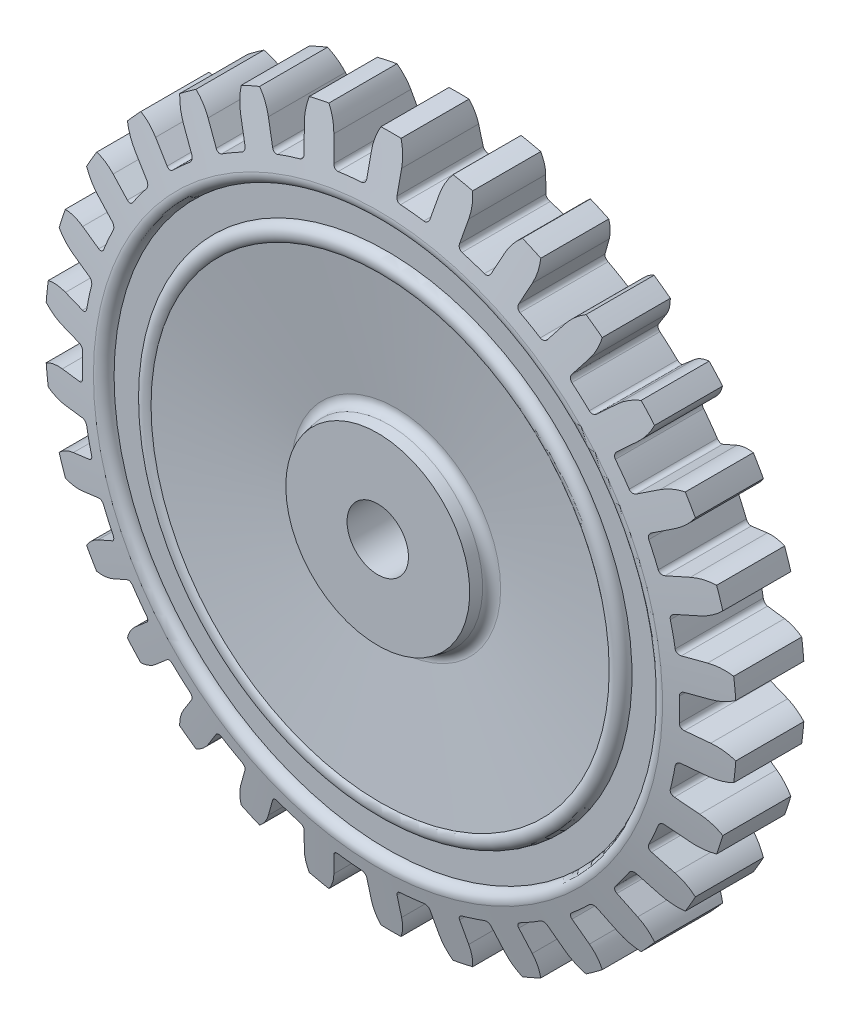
SolidWorks part; units mm, degrees
ref_plane "Спереди" through (0, 0, 0) normal (0, 0, 1) x (1, 0, 0)
ref_plane "Сверху" through (0, 0, 0) normal (0, 1, 0) x (1, 0, 0)
ref_plane "Справа" through (0, 0, 0) normal (1, 0, 0) x (0, 0, -1)
sketch "Эскиз1" plane through (0, 0, 0) normal (0, 1, 0) x (1, 0, 0)
  line L0 (-36.6, 0) -> (0, 0) construction
  line L1 (-36.6, -3.6) -> (-36.6, 3.6)
  line L2 (-3.25, 5) -> (-3.25, -5)
  line L3 (-3.25, 5) -> (-9.735, 5)
  line L4 (-36.6, 3.6) -> (-30.1163, 4.9781)
  line L5 (-28.9084, 4) -> (-25.9084, 4)
  line L6 (-9.735, 5) -> (-9.9607, 3.8603)
  line L7 (-11.0686, 3.0627) -> (-24.247, 4.75)
  line L8 (-3.25, -5) -> (-9.735, -5)
  line L9 (-9.735, -5) -> (-9.9607, -3.8603)
  line L10 (-11.0686, -3.0627) -> (-24.247, -4.75)
  line L11 (-28.9084, -4) -> (-25.9084, -4)
  line L12 (-36.6, -3.6) -> (-30.1163, -4.9781)
  line L13 (0, 5) -> (0, -5) construction
  arc A0 (-28.9084, 4) -> (-30.1163, 4.9781) centre (-29.9084, 4) ccw
  arc A1 (-24.247, 4.75) -> (-25.9084, 4) centre (-24.9084, 4) ccw
  arc A2 (-9.9607, 3.8603) -> (-11.0686, 3.0627) centre (-10.9416, 4.0546) cw
  arc A3 (-9.9607, -3.8603) -> (-11.0686, -3.0627) centre (-10.9416, -4.0546) ccw
  arc A4 (-24.247, -4.75) -> (-25.9084, -4) centre (-24.9084, -4) cw
  arc A5 (-28.9084, -4) -> (-30.1163, -4.9781) centre (-29.9084, -4) cw
  point P17 (-3.25, 0)
  dimension "D7" = 2
  dimension "D13" = 1
  dimension "D1" = 36.6
  dimension "D2" = 3.25
  dimension "D3" = 5
  dimension "D4" = 6.485
  dimension "D5" = 3.6
  dimension "D6" = 12
  dimension "D8" = 3
  dimension "D9" = 4
  dimension "D10" = 11.2
  dimension "D11" = 7.296
  dimension "D12" = 0.25
revolve "Повернуть1" add sketch "Эскиз1" angle 360 about L13
sketch "Эскиз6" plane through (0, 0, 0) normal (0, 0, 1) x (1, 0, 0)
  line L0 (0, 50.9999) -> (0, 0) construction
  line L1 (1.6, 34.3321) -> (1.6, 32.0312)
  line L2 (0, 0) -> (3.3816, 34.3339) construction
  line L3 (-1.6, 34.3321) -> (-1.6, 32.0312)
  line L4 (8.7031, 33.2492) -> (8.2247, 30.9986)
  line L5 (5.573, 33.9145) -> (5.0946, 31.6639)
  line L6 (15.4258, 30.7131) -> (14.4899, 28.6112)
  line L7 (12.5024, 32.0147) -> (11.5666, 29.9128)
  line L8 (21.4743, 26.8348) -> (20.1219, 24.9734)
  line L9 (18.8854, 28.7157) -> (17.5331, 26.8543)
  line L10 (26.5843, 21.7836) -> (24.8745, 20.244)
  line L11 (24.4431, 24.1617) -> (22.7332, 22.6221)
  line L12 (30.5324, 15.7804) -> (28.5399, 14.63)
  line L13 (28.9324, 18.5517) -> (26.9399, 17.4013)
  line L14 (33.1462, 9.0875) -> (30.9579, 8.3765)
  line L15 (32.1573, 12.1309) -> (29.9691, 11.4199)
  line L16 (34.3112, 1.9974) -> (32.023, 1.7569)
  line L17 (33.9767, 5.1799) -> (31.6885, 4.9394)
  line L18 (33.9767, -5.1799) -> (31.6885, -4.9394)
  line L19 (34.3112, -1.9974) -> (32.023, -1.7569)
  line L20 (32.1573, -12.1309) -> (29.9691, -11.4199)
  line L21 (33.1462, -9.0875) -> (30.9579, -8.3765)
  line L22 (28.9324, -18.5517) -> (26.9399, -17.4013)
  line L23 (30.5324, -15.7804) -> (28.5399, -14.63)
  line L24 (24.4431, -24.1617) -> (22.7332, -22.6221)
  line L25 (26.5843, -21.7836) -> (24.8745, -20.244)
  line L26 (18.8854, -28.7157) -> (17.5331, -26.8543)
  line L27 (21.4743, -26.8348) -> (20.1219, -24.9734)
  line L28 (12.5024, -32.0147) -> (11.5666, -29.9128)
  line L29 (15.4258, -30.7131) -> (14.4899, -28.6112)
  line L30 (5.573, -33.9145) -> (5.0946, -31.6639)
  line L31 (8.7031, -33.2492) -> (8.2247, -30.9986)
  line L32 (-1.6, -34.3321) -> (-1.6, -32.0312)
  line L33 (1.6, -34.3321) -> (1.6, -32.0312)
  line L34 (-8.7031, -33.2492) -> (-8.2247, -30.9986)
  line L35 (-5.573, -33.9145) -> (-5.0946, -31.6639)
  line L36 (-15.4258, -30.7131) -> (-14.4899, -28.6112)
  line L37 (-12.5024, -32.0147) -> (-11.5666, -29.9128)
  line L38 (-21.4743, -26.8348) -> (-20.1219, -24.9734)
  line L39 (-18.8854, -28.7157) -> (-17.5331, -26.8543)
  line L40 (-26.5843, -21.7836) -> (-24.8745, -20.244)
  line L41 (-24.4431, -24.1617) -> (-22.7332, -22.6221)
  line L42 (-30.5324, -15.7804) -> (-28.5399, -14.63)
  line L43 (-28.9324, -18.5517) -> (-26.9399, -17.4013)
  line L44 (-33.1462, -9.0875) -> (-30.9579, -8.3765)
  line L45 (-32.1573, -12.1309) -> (-29.9691, -11.4199)
  line L46 (-34.3112, -1.9974) -> (-32.023, -1.7569)
  line L47 (-33.9767, -5.1799) -> (-31.6885, -4.9394)
  line L48 (-33.9767, 5.1799) -> (-31.6885, 4.9394)
  line L49 (-34.3112, 1.9974) -> (-32.023, 1.7569)
  line L50 (-32.1573, 12.1309) -> (-29.9691, 11.4199)
  line L51 (-33.1462, 9.0875) -> (-30.9579, 8.3765)
  line L52 (-28.9324, 18.5517) -> (-26.9399, 17.4013)
  line L53 (-30.5324, 15.7804) -> (-28.5399, 14.63)
  line L54 (-24.4431, 24.1617) -> (-22.7332, 22.6221)
  line L55 (-26.5843, 21.7836) -> (-24.8745, 20.244)
  line L56 (-18.8854, 28.7157) -> (-17.5331, 26.8543)
  line L57 (-21.4743, 26.8348) -> (-20.1219, 24.9734)
  line L58 (-12.5024, 32.0147) -> (-11.5666, 29.9128)
  line L59 (-15.4258, 30.7131) -> (-14.4899, 28.6112)
  line L60 (-5.573, 33.9145) -> (-5.0946, 31.6639)
  line L61 (-8.7031, 33.2492) -> (-8.2247, 30.9986)
  arc A0 (-2.0673, 31.5323) -> (-4.5338, 31.2731) centre (0, 0) ccw
  circle A1 centre (0, 0) radius 34.5 construction
  circle A2 centre (0, 0) radius 36.6 construction
  arc A3 (1.0639, 36.5845) -> (-1.0639, 36.5845) centre (0, 0) ccw
  arc A4 (-1.0639, 36.5845) -> (-1.6, 34.3321) centre (3.4, 34.3321) ccw
  arc A5 (1.6, 32.0312) -> (2.0673, 31.5323) centre (2.1, 32.0312) ccw
  arc A6 (1.0639, 36.5845) -> (1.6, 34.3321) centre (-3.4, 34.3321) cw
  arc A7 (4.5338, 31.2731) -> (2.0673, 31.5323) centre (0, 0) ccw
  arc A8 (8.647, 35.5639) -> (6.5657, 36.0063) centre (0, 0) ccw
  arc A9 (6.5657, 36.0063) -> (5.573, 33.9145) centre (10.4637, 32.8749) ccw
  arc A10 (8.2247, 30.9986) -> (8.578, 30.4134) centre (8.7138, 30.8947) ccw
  arc A11 (8.647, 35.5639) -> (8.7031, 33.2492) centre (3.8123, 34.2887) cw
  arc A12 (5.0946, 31.6639) -> (4.5338, 31.2731) centre (4.6056, 31.7679) cw
  arc A13 (10.9368, 29.647) -> (8.578, 30.4134) centre (0, 0) ccw
  arc A14 (15.8522, 32.9889) -> (13.9084, 33.8544) centre (0, 0) ccw
  arc A15 (13.9084, 33.8544) -> (12.5024, 32.0147) centre (17.0702, 29.981) ccw
  arc A16 (14.4899, 28.6112) -> (14.7139, 27.9654) centre (14.9467, 28.4078) ccw
  arc A17 (15.8522, 32.9889) -> (15.4258, 30.7131) centre (10.8581, 32.7468) cw
  arc A18 (11.5666, 29.9128) -> (10.9368, 29.647) centre (11.1098, 30.1161) cw
  arc A19 (16.8618, 26.7253) -> (14.7139, 27.9654) centre (0, 0) ccw
  arc A20 (22.3646, 28.9722) -> (20.6431, 30.2229) centre (0, 0) ccw
  arc A21 (20.6431, 30.2229) -> (18.8854, 28.7157) centre (22.9305, 25.7767) ccw
  arc A22 (20.1219, 24.9734) -> (20.2067, 24.295) centre (20.5264, 24.6795) ccw
  arc A23 (22.3646, 28.9722) -> (21.4743, 26.8348) centre (17.4292, 29.7737) cw
  arc A24 (17.5331, 26.8543) -> (16.8618, 26.7253) centre (17.1286, 27.1482) cw
  arc A25 (22.0498, 22.6355) -> (20.2067, 24.295) centre (0, 0) ccw
  arc A26 (27.8995, 23.6892) -> (26.4757, 25.2705) centre (0, 0) ccw
  arc A27 (26.4757, 25.2705) -> (24.4431, 24.1617) centre (27.7887, 20.4459) ccw
  arc A28 (24.8745, 20.244) -> (24.8164, 19.5629) centre (25.209, 19.8725) ccw
  arc A29 (27.8995, 23.6892) -> (26.5843, 21.7836) centre (23.2386, 25.4993) cw
  arc A30 (22.7332, 22.6221) -> (22.0498, 22.6355) centre (22.3987, 22.9937) cw
  arc A31 (26.2741, 17.5565) -> (24.8164, 19.5629) centre (0, 0) ccw
  arc A32 (32.2151, 17.3709) -> (31.1512, 19.2136) centre (0, 0) ccw
  arc A33 (31.1512, 19.2136) -> (28.9324, 18.5517) centre (31.4324, 14.2215) ccw
  arc A34 (28.5399, 14.63) -> (28.3414, 13.9758) centre (28.7899, 14.197) ccw
  arc A35 (32.2151, 17.3709) -> (30.5324, 15.7804) centre (28.0324, 20.1105) cw
  arc A36 (26.9399, 17.4013) -> (26.2741, 17.5565) centre (26.6899, 17.8343) cw
  arc A37 (29.3502, 11.7101) -> (28.3414, 13.9758) centre (0, 0) ccw
  arc A38 (35.1227, 10.2934) -> (34.4652, 12.3171) centre (0, 0) ccw
  arc A39 (34.4652, 12.3171) -> (32.1573, 12.1309) centre (33.7024, 7.3756) ccw
  arc A40 (30.9579, 8.3765) -> (30.6278, 7.7779) centre (31.1125, 7.901) ccw
  arc A41 (35.1227, 10.2934) -> (33.1462, 9.0875) centre (31.6011, 13.8428) cw
  arc A42 (29.9691, 11.4199) -> (29.3502, 11.7101) centre (29.8146, 11.8954) cw
  arc A43 (31.1435, 5.352) -> (30.6278, 7.7779) centre (0, 0) ccw
  arc A44 (36.4953, 2.7661) -> (36.2729, 4.8822) centre (0, 0) ccw
  arc A45 (36.2729, 4.8822) -> (33.9767, 5.1799) centre (34.4994, 0.2073) ccw
  arc A46 (32.023, 1.7569) -> (31.5757, 1.2401) centre (32.0753, 1.2597) ccw
  arc A47 (36.4953, 2.7661) -> (34.3112, 1.9974) centre (33.7886, 6.9701) cw
  arc A48 (31.6885, 4.9394) -> (31.1435, 5.352) centre (31.6363, 5.4367) cw
  arc A49 (31.5757, -1.2401) -> (31.5757, 1.2401) centre (0, 0) ccw
  arc A50 (36.2729, -4.8822) -> (36.4953, -2.7661) centre (0, 0) ccw
  arc A51 (36.4953, -2.7661) -> (34.3112, -1.9974) centre (33.7886, -6.9701) ccw
  arc A52 (31.6885, -4.9394) -> (31.1435, -5.352) centre (31.6363, -5.4367) ccw
  arc A53 (36.2729, -4.8822) -> (33.9767, -5.1799) centre (34.4994, -0.2073) cw
  arc A54 (32.023, -1.7569) -> (31.5757, -1.2401) centre (32.0753, -1.2597) cw
  arc A55 (30.6278, -7.7779) -> (31.1435, -5.352) centre (0, 0) ccw
  arc A56 (34.4652, -12.3171) -> (35.1227, -10.2934) centre (0, 0) ccw
  arc A57 (35.1227, -10.2934) -> (33.1462, -9.0875) centre (31.6011, -13.8428) ccw
  arc A58 (29.9691, -11.4199) -> (29.3502, -11.7101) centre (29.8146, -11.8954) ccw
  arc A59 (34.4652, -12.3171) -> (32.1573, -12.1309) centre (33.7024, -7.3756) cw
  arc A60 (30.9579, -8.3765) -> (30.6278, -7.7779) centre (31.1125, -7.901) cw
  arc A61 (28.3414, -13.9758) -> (29.3502, -11.7101) centre (0, 0) ccw
  arc A62 (31.1512, -19.2136) -> (32.2151, -17.3709) centre (0, 0) ccw
  arc A63 (32.2151, -17.3709) -> (30.5324, -15.7804) centre (28.0324, -20.1105) ccw
  arc A64 (26.9399, -17.4013) -> (26.2741, -17.5565) centre (26.6899, -17.8343) ccw
  arc A65 (31.1512, -19.2136) -> (28.9324, -18.5517) centre (31.4324, -14.2215) cw
  arc A66 (28.5399, -14.63) -> (28.3414, -13.9758) centre (28.7899, -14.197) cw
  arc A67 (24.8164, -19.5629) -> (26.2741, -17.5565) centre (0, 0) ccw
  arc A68 (26.4757, -25.2705) -> (27.8995, -23.6892) centre (0, 0) ccw
  arc A69 (27.8995, -23.6892) -> (26.5843, -21.7836) centre (23.2386, -25.4993) ccw
  arc A70 (22.7332, -22.6221) -> (22.0498, -22.6355) centre (22.3987, -22.9937) ccw
  arc A71 (26.4757, -25.2705) -> (24.4431, -24.1617) centre (27.7887, -20.4459) cw
  arc A72 (24.8745, -20.244) -> (24.8164, -19.5629) centre (25.209, -19.8725) cw
  arc A73 (20.2067, -24.295) -> (22.0498, -22.6355) centre (0, 0) ccw
  arc A74 (20.6431, -30.2229) -> (22.3646, -28.9722) centre (0, 0) ccw
  arc A75 (22.3646, -28.9722) -> (21.4743, -26.8348) centre (17.4292, -29.7737) ccw
  arc A76 (17.5331, -26.8543) -> (16.8618, -26.7253) centre (17.1286, -27.1482) ccw
  arc A77 (20.6431, -30.2229) -> (18.8854, -28.7157) centre (22.9305, -25.7767) cw
  arc A78 (20.1219, -24.9734) -> (20.2067, -24.295) centre (20.5264, -24.6795) cw
  arc A79 (14.7139, -27.9654) -> (16.8618, -26.7253) centre (0, 0) ccw
  arc A80 (13.9084, -33.8544) -> (15.8522, -32.9889) centre (0, 0) ccw
  arc A81 (15.8522, -32.9889) -> (15.4258, -30.7131) centre (10.8581, -32.7468) ccw
  arc A82 (11.5666, -29.9128) -> (10.9368, -29.647) centre (11.1098, -30.1161) ccw
  arc A83 (13.9084, -33.8544) -> (12.5024, -32.0147) centre (17.0702, -29.981) cw
  arc A84 (14.4899, -28.6112) -> (14.7139, -27.9654) centre (14.9467, -28.4078) cw
  arc A85 (8.578, -30.4134) -> (10.9368, -29.647) centre (0, 0) ccw
  arc A86 (6.5657, -36.0063) -> (8.647, -35.5639) centre (0, 0) ccw
  arc A87 (8.647, -35.5639) -> (8.7031, -33.2492) centre (3.8123, -34.2887) ccw
  arc A88 (5.0946, -31.6639) -> (4.5338, -31.2731) centre (4.6056, -31.7679) ccw
  arc A89 (6.5657, -36.0063) -> (5.573, -33.9145) centre (10.4637, -32.8749) cw
  arc A90 (8.2247, -30.9986) -> (8.578, -30.4134) centre (8.7138, -30.8947) cw
  arc A91 (2.0673, -31.5323) -> (4.5338, -31.2731) centre (0, 0) ccw
  arc A92 (-1.0639, -36.5845) -> (1.0639, -36.5845) centre (0, 0) ccw
  arc A93 (1.0639, -36.5845) -> (1.6, -34.3321) centre (-3.4, -34.3321) ccw
  arc A94 (-1.6, -32.0312) -> (-2.0673, -31.5323) centre (-2.1, -32.0312) ccw
  arc A95 (-1.0639, -36.5845) -> (-1.6, -34.3321) centre (3.4, -34.3321) cw
  arc A96 (1.6, -32.0312) -> (2.0673, -31.5323) centre (2.1, -32.0312) cw
  arc A97 (-4.5338, -31.2731) -> (-2.0673, -31.5323) centre (0, 0) ccw
  arc A98 (-8.647, -35.5639) -> (-6.5657, -36.0063) centre (0, 0) ccw
  arc A99 (-6.5657, -36.0063) -> (-5.573, -33.9145) centre (-10.4637, -32.8749) ccw
  arc A100 (-8.2247, -30.9986) -> (-8.578, -30.4134) centre (-8.7138, -30.8947) ccw
  arc A101 (-8.647, -35.5639) -> (-8.7031, -33.2492) centre (-3.8123, -34.2887) cw
  arc A102 (-5.0946, -31.6639) -> (-4.5338, -31.2731) centre (-4.6056, -31.7679) cw
  arc A103 (-10.9368, -29.647) -> (-8.578, -30.4134) centre (0, 0) ccw
  arc A104 (-15.8522, -32.9889) -> (-13.9084, -33.8544) centre (0, 0) ccw
  arc A105 (-13.9084, -33.8544) -> (-12.5024, -32.0147) centre (-17.0702, -29.981) ccw
  arc A106 (-14.4899, -28.6112) -> (-14.7139, -27.9654) centre (-14.9467, -28.4078) ccw
  arc A107 (-15.8522, -32.9889) -> (-15.4258, -30.7131) centre (-10.8581, -32.7468) cw
  arc A108 (-11.5666, -29.9128) -> (-10.9368, -29.647) centre (-11.1098, -30.1161) cw
  arc A109 (-16.8618, -26.7253) -> (-14.7139, -27.9654) centre (0, 0) ccw
  arc A110 (-22.3646, -28.9722) -> (-20.6431, -30.2229) centre (0, 0) ccw
  arc A111 (-20.6431, -30.2229) -> (-18.8854, -28.7157) centre (-22.9305, -25.7767) ccw
  arc A112 (-20.1219, -24.9734) -> (-20.2067, -24.295) centre (-20.5264, -24.6795) ccw
  arc A113 (-22.3646, -28.9722) -> (-21.4743, -26.8348) centre (-17.4292, -29.7737) cw
  arc A114 (-17.5331, -26.8543) -> (-16.8618, -26.7253) centre (-17.1286, -27.1482) cw
  arc A115 (-22.0498, -22.6355) -> (-20.2067, -24.295) centre (0, 0) ccw
  arc A116 (-27.8995, -23.6892) -> (-26.4757, -25.2705) centre (0, 0) ccw
  arc A117 (-26.4757, -25.2705) -> (-24.4431, -24.1617) centre (-27.7887, -20.4459) ccw
  arc A118 (-24.8745, -20.244) -> (-24.8164, -19.5629) centre (-25.209, -19.8725) ccw
  arc A119 (-27.8995, -23.6892) -> (-26.5843, -21.7836) centre (-23.2386, -25.4993) cw
  arc A120 (-22.7332, -22.6221) -> (-22.0498, -22.6355) centre (-22.3987, -22.9937) cw
  arc A121 (-26.2741, -17.5565) -> (-24.8164, -19.5629) centre (0, 0) ccw
  arc A122 (-32.2151, -17.3709) -> (-31.1512, -19.2136) centre (0, 0) ccw
  arc A123 (-31.1512, -19.2136) -> (-28.9324, -18.5517) centre (-31.4324, -14.2215) ccw
  arc A124 (-28.5399, -14.63) -> (-28.3414, -13.9758) centre (-28.7899, -14.197) ccw
  arc A125 (-32.2151, -17.3709) -> (-30.5324, -15.7804) centre (-28.0324, -20.1105) cw
  arc A126 (-26.9399, -17.4013) -> (-26.2741, -17.5565) centre (-26.6899, -17.8343) cw
  arc A127 (-29.3502, -11.7101) -> (-28.3414, -13.9758) centre (0, 0) ccw
  arc A128 (-35.1227, -10.2934) -> (-34.4652, -12.3171) centre (0, 0) ccw
  arc A129 (-34.4652, -12.3171) -> (-32.1573, -12.1309) centre (-33.7024, -7.3756) ccw
  arc A130 (-30.9579, -8.3765) -> (-30.6278, -7.7779) centre (-31.1125, -7.901) ccw
  arc A131 (-35.1227, -10.2934) -> (-33.1462, -9.0875) centre (-31.6011, -13.8428) cw
  arc A132 (-29.9691, -11.4199) -> (-29.3502, -11.7101) centre (-29.8146, -11.8954) cw
  arc A133 (-31.1435, -5.352) -> (-30.6278, -7.7779) centre (0, 0) ccw
  arc A134 (-36.4953, -2.7661) -> (-36.2729, -4.8822) centre (0, 0) ccw
  arc A135 (-36.2729, -4.8822) -> (-33.9767, -5.1799) centre (-34.4994, -0.2073) ccw
  arc A136 (-32.023, -1.7569) -> (-31.5757, -1.2401) centre (-32.0753, -1.2597) ccw
  arc A137 (-36.4953, -2.7661) -> (-34.3112, -1.9974) centre (-33.7886, -6.9701) cw
  arc A138 (-31.6885, -4.9394) -> (-31.1435, -5.352) centre (-31.6363, -5.4367) cw
  arc A139 (-31.5757, 1.2401) -> (-31.5757, -1.2401) centre (0, 0) ccw
  arc A140 (-36.2729, 4.8822) -> (-36.4953, 2.7661) centre (0, 0) ccw
  arc A141 (-36.4953, 2.7661) -> (-34.3112, 1.9974) centre (-33.7886, 6.9701) ccw
  arc A142 (-31.6885, 4.9394) -> (-31.1435, 5.352) centre (-31.6363, 5.4367) ccw
  arc A143 (-36.2729, 4.8822) -> (-33.9767, 5.1799) centre (-34.4994, 0.2073) cw
  arc A144 (-32.023, 1.7569) -> (-31.5757, 1.2401) centre (-32.0753, 1.2597) cw
  arc A145 (-30.6278, 7.7779) -> (-31.1435, 5.352) centre (0, 0) ccw
  arc A146 (-34.4652, 12.3171) -> (-35.1227, 10.2934) centre (0, 0) ccw
  arc A147 (-35.1227, 10.2934) -> (-33.1462, 9.0875) centre (-31.6011, 13.8428) ccw
  arc A148 (-29.9691, 11.4199) -> (-29.3502, 11.7101) centre (-29.8146, 11.8954) ccw
  arc A149 (-34.4652, 12.3171) -> (-32.1573, 12.1309) centre (-33.7024, 7.3756) cw
  arc A150 (-30.9579, 8.3765) -> (-30.6278, 7.7779) centre (-31.1125, 7.901) cw
  arc A151 (-28.3414, 13.9758) -> (-29.3502, 11.7101) centre (0, 0) ccw
  arc A152 (-31.1512, 19.2136) -> (-32.2151, 17.3709) centre (0, 0) ccw
  arc A153 (-32.2151, 17.3709) -> (-30.5324, 15.7804) centre (-28.0324, 20.1105) ccw
  arc A154 (-26.9399, 17.4013) -> (-26.2741, 17.5565) centre (-26.6899, 17.8343) ccw
  arc A155 (-31.1512, 19.2136) -> (-28.9324, 18.5517) centre (-31.4324, 14.2215) cw
  arc A156 (-28.5399, 14.63) -> (-28.3414, 13.9758) centre (-28.7899, 14.197) cw
  arc A157 (-24.8164, 19.5629) -> (-26.2741, 17.5565) centre (0, 0) ccw
  arc A158 (-26.4757, 25.2705) -> (-27.8995, 23.6892) centre (0, 0) ccw
  arc A159 (-27.8995, 23.6892) -> (-26.5843, 21.7836) centre (-23.2386, 25.4993) ccw
  arc A160 (-22.7332, 22.6221) -> (-22.0498, 22.6355) centre (-22.3987, 22.9937) ccw
  arc A161 (-26.4757, 25.2705) -> (-24.4431, 24.1617) centre (-27.7887, 20.4459) cw
  arc A162 (-24.8745, 20.244) -> (-24.8164, 19.5629) centre (-25.209, 19.8725) cw
  arc A163 (-20.2067, 24.295) -> (-22.0498, 22.6355) centre (0, 0) ccw
  arc A164 (-20.6431, 30.2229) -> (-22.3646, 28.9722) centre (0, 0) ccw
  arc A165 (-22.3646, 28.9722) -> (-21.4743, 26.8348) centre (-17.4292, 29.7737) ccw
  arc A166 (-17.5331, 26.8543) -> (-16.8618, 26.7253) centre (-17.1286, 27.1482) ccw
  arc A167 (-20.6431, 30.2229) -> (-18.8854, 28.7157) centre (-22.9305, 25.7767) cw
  arc A168 (-20.1219, 24.9734) -> (-20.2067, 24.295) centre (-20.5264, 24.6795) cw
  arc A169 (-14.7139, 27.9654) -> (-16.8618, 26.7253) centre (0, 0) ccw
  arc A170 (-13.9084, 33.8544) -> (-15.8522, 32.9889) centre (0, 0) ccw
  arc A171 (-15.8522, 32.9889) -> (-15.4258, 30.7131) centre (-10.8581, 32.7468) ccw
  arc A172 (-11.5666, 29.9128) -> (-10.9368, 29.647) centre (-11.1098, 30.1161) ccw
  arc A173 (-13.9084, 33.8544) -> (-12.5024, 32.0147) centre (-17.0702, 29.981) cw
  arc A174 (-14.4899, 28.6112) -> (-14.7139, 27.9654) centre (-14.9467, 28.4078) cw
  arc A175 (-8.578, 30.4134) -> (-10.9368, 29.647) centre (0, 0) ccw
  arc A176 (-6.5657, 36.0063) -> (-8.647, 35.5639) centre (0, 0) ccw
  arc A177 (-8.647, 35.5639) -> (-8.7031, 33.2492) centre (-3.8123, 34.2887) ccw
  arc A178 (-5.0946, 31.6639) -> (-4.5338, 31.2731) centre (-4.6056, 31.7679) ccw
  arc A179 (-6.5657, 36.0063) -> (-5.573, 33.9145) centre (-10.4637, 32.8749) cw
  arc A180 (-8.2247, 30.9986) -> (-8.578, 30.4134) centre (-8.7138, 30.8947) cw
  arc A192 (-1.6, 32.0312) -> (-2.0673, 31.5323) centre (-2.1, 32.0312) cw
  point P30 (8.1266, 30.5372)
  point P45 (14.2981, 28.1802)
  point P60 (19.8446, 24.5917)
  point P75 (24.5239, 19.9284)
  point P90 (28.1313, 14.3941)
  point P105 (30.5093, 8.2307)
  point P120 (31.5538, 1.7076)
  point P135 (31.2193, -4.8901)
  point P150 (29.5204, -11.2741)
  point P165 (26.5313, -17.1654)
  point P180 (22.3826, -22.3064)
  point P195 (17.2558, -26.4726)
  point P210 (11.3747, -29.4818)
  point P225 (4.9965, -31.2025)
  point P240 (-1.6, -31.5595)
  point P255 (-8.1266, -30.5372)
  point P270 (-14.2981, -28.1802)
  point P285 (-19.8446, -24.5917)
  point P300 (-24.5239, -19.9284)
  point P315 (-28.1313, -14.3941)
  point P330 (-30.5093, -8.2307)
  point P345 (-31.5538, -1.7076)
  point P360 (-31.2193, 4.8901)
  point P375 (-29.5204, 11.2741)
  point P390 (-26.5313, 17.1654)
  point P405 (1.6, 31.5595)
  point P406 (-22.3826, 22.3064)
  point P420 (-1.6, 31.5595)
  point P425 (-17.2558, 26.4726)
  point P440 (-11.3747, 29.4818)
  point P455 (-4.9965, 31.2025)
  dimension "D1" = 63.2
  dimension "D2" = 69
  dimension "D5" = 10
  dimension "D7" = 30
  dimension "D6" = 0.5
  dimension "D3" = 1.6
  dimension "D4" = 5.625
extrude "Вырез-Вытянуть3" cut sketch "Эскиз6" against normal mid plane 10 flip side to cut
